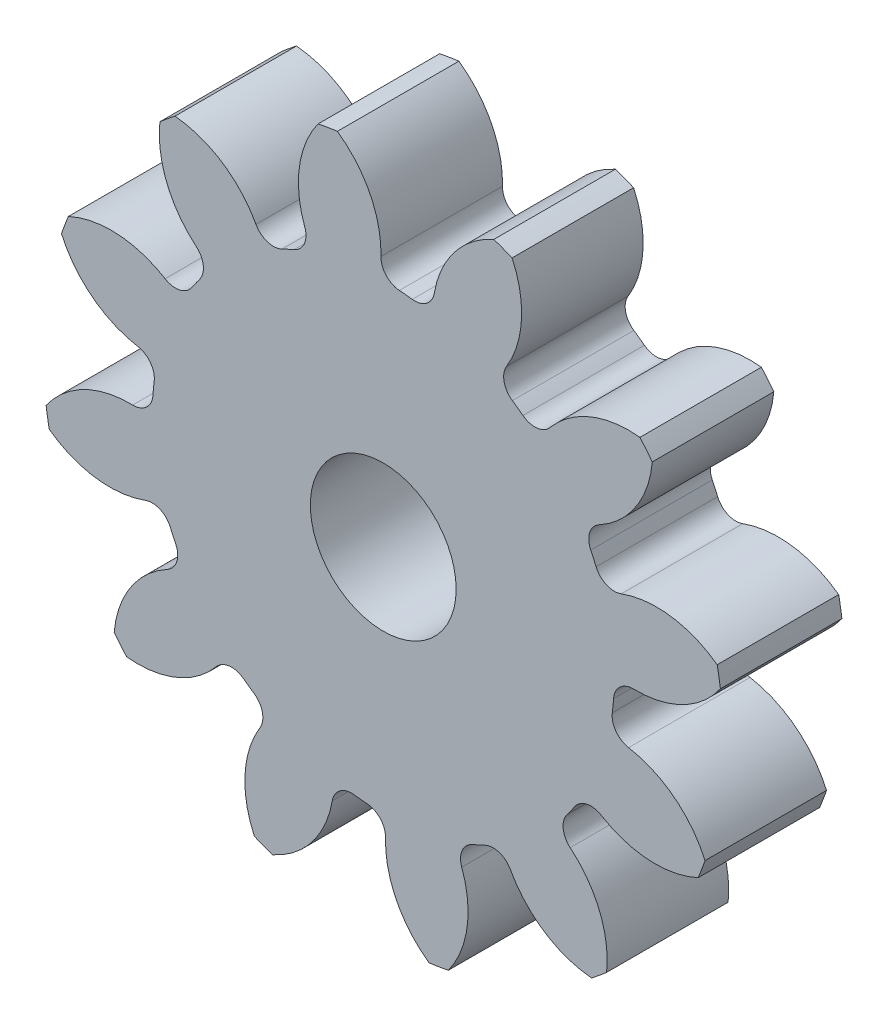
SolidWorks part; units mm, degrees
ref_plane "Front" through (0, 0, 0) normal (0, 0, 1) x (1, 0, 0)
ref_plane "Top" through (0, 0, 0) normal (0, 1, 0) x (1, 0, 0)
ref_plane "Right" through (0, 0, 0) normal (1, 0, 0) x (0, 0, -1)
sketch "Sketch3" plane through (0, 0, 0) normal (0, 0, 1) x (1, 0, 0)
  circle A0 centre (0, 0) radius 355.6
  dimension "od" = 711.2
extrude "gearBody" add sketch "Sketch3" along normal blind 127
sketch "Sketch2" plane through (0, 0, 0) normal (0, 0, 1) x (1, 0, 0)
  line L0 (0, 0) -> (264.616, 109.6075) construction
  line L1 (338.5196, -121.0102) -> (0, 0) construction
  line L2 (0, 0) -> (36.3143, 0) construction
  line L3 (304.633, 10.0884) -> (296.8416, -69.1963) construction
  line L5 (300.7373, -29.5539) -> (0, 0) construction
  line L7 (0, 0) -> (286.4183, 0) construction
  arc A0 (286.3818, 4.5758) -> (280.0126, -60.2363) centre (0, 0) ccw construction
  arc A1 (352.358, 47.9086) -> (336.2914, -115.5832) centre (0, 0) ccw construction
  arc A2 (304.633, 10.0884) -> (296.8416, -69.1963) centre (0, 0) ccw construction
  arc A3 (239.3858, -30.334) -> (240.7113, -16.8459) centre (0, 0) ccw
  arc A4 (338.5196, -121.0102) -> (256.3937, -53.3097) centre (238.2174, -159.0217) ccw
  arc A5 (338.5196, -121.0102) -> (355.6, 52.798) centre (0, 0) ccw
  arc A6 (355.6, 52.798) -> (261.8664, 2.3795) centre (264.616, 109.6075) cw
  arc A7 (240.7113, -16.8459) -> (261.8664, 2.3795) centre (261.3364, -18.2893) cw
  arc A8 (256.3937, -53.3097) -> (239.3858, -30.334) centre (259.8973, -32.9331) cw
  point P6 (355.6, 52.798)
  point P22 (338.5196, -121.0102)
  dimension "baseDia" = 572.8366
  dimension "od" = 711.2
  dimension "pd" = 609.6
  dimension "rd" = 482.6
  dimension "rFillet" = 20.6756
  dimension "pointX" = 355.6
  dimension "pointY" = 52.798
  dimension "CTT" = 79.2847
  dimension "flankCenterAngle" = 22.5
extrude "toothCut" cut sketch "Sketch2" along normal through all
pattern_circular "CirPattern1" count 12 over 360 about axis through (0, 0, 0) along (0, 0, 1) of "toothCut"
sketch "hub1Dia" plane through (0, 0, 0) normal (0, 0, -1) x (-1, 0, 0)
  circle A0 centre (0, 0) radius 12.7
  dimension "hub1Dia" = 25.4
sketch "hub2Dia" plane through (0, 0, 127) normal (0, 0, 1) x (1, 0, 0)
  circle A0 centre (0, 0) radius 12.7
  dimension "hub2dia" = 25.4
sketch "boreDia" plane through (0, 0, 0) normal (0, 0, 1) x (1, 0, 0)
  circle A0 centre (0, 0) radius 76.2
  dimension "boreDia" = 152.4
extrude "bore" cut sketch "boreDia" against normal mid plane 25400
